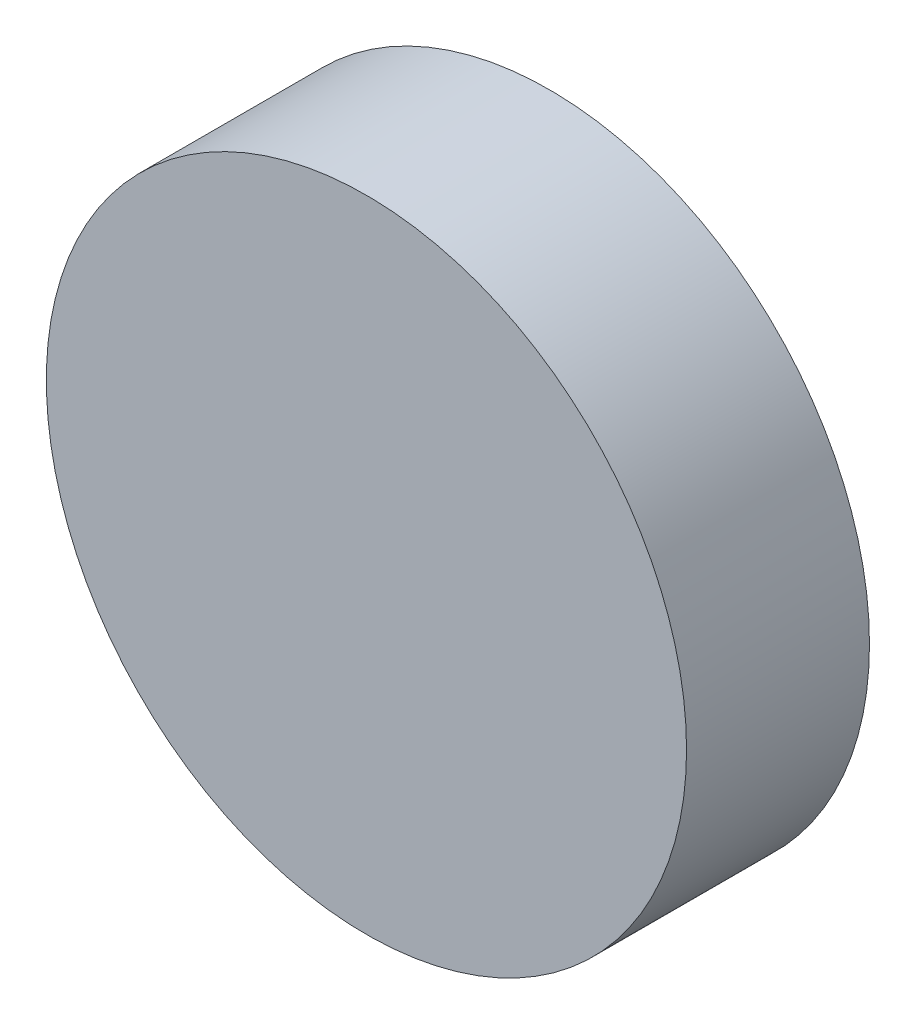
SolidWorks part; units mm, degrees
ref_plane "Ebene vorne" through (0, 0, 0) normal (0, 0, 1) x (1, 0, 0)
ref_plane "Ebene oben" through (0, 0, 0) normal (0, 1, 0) x (1, 0, 0)
ref_plane "Ebene rechts" through (0, 0, 0) normal (1, 0, 0) x (0, 0, -1)
sketch "Skizze2" plane through (0, 0, 0) normal (0, 0, 1) x (1, 0, 0)
  circle A0 centre (0, 50) radius 17.5 construction
  circle A1 centre (0, 50) radius 17.5
extrude "Aufsatz-Linear austragen1" add sketch "Skizze2" along normal blind 10 from offset 30
